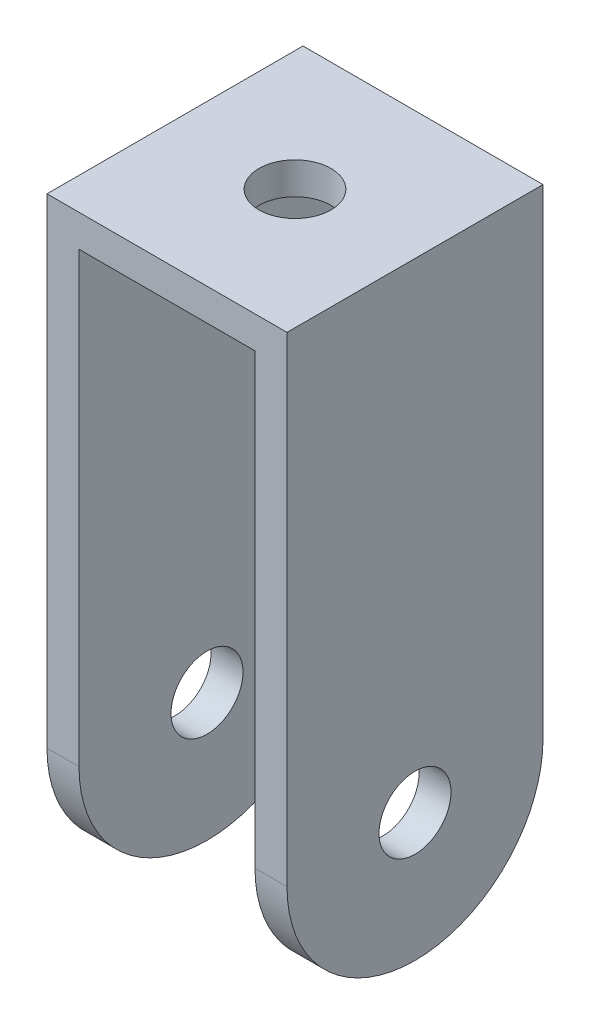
SolidWorks part; units mm, degrees
ref_plane "Front Plane" through (0, 0, 0) normal (0, 0, 1) x (1, 0, 0)
ref_plane "Top Plane" through (0, 0, 0) normal (0, 1, 0) x (1, 0, 0)
ref_plane "Right Plane" through (0, 0, 0) normal (1, 0, 0) x (0, 0, -1)
sketch "Sketch1" plane through (0, 0, 0) normal (0, 0, 1) x (1, 0, 0)
  line L0 (0, 0) -> (0, 45.2301)
  line L1 (0, 45.2301) -> (15, 45.2301)
  line L2 (15, 45.2301) -> (15, 0)
  line L3 (15, 0) -> (13, 0)
  line L4 (13, 0) -> (13, 43.2301)
  line L5 (13, 43.2301) -> (2, 43.2301)
  line L6 (2, 43.2301) -> (2, 0)
  line L7 (2, 0) -> (0, 0)
  dimension "D1" = 15
  dimension "D2" = 2
  dimension "D3" = 2
  dimension "D4" = 2
extrude "Extrude1" add sketch "Sketch1" along normal blind 16
sketch "Sketch2" plane through (0, 45.2301, 0) normal (0, 1, 0) x (1, 0, 0)
  line L0 (0, 0) -> (15, -16) construction
  circle A0 centre (7.5, -8) radius 2.25
  dimension "D1" = 4.5
extrude "Extrude2" cut sketch "Sketch2" against normal through all
sketch "Sketch3" plane through (15, 0, 0) normal (1, 0, 0) x (0, 0, -1)
  line L0 (-8, 45.2301) -> (-8, 15.2301) construction
  line L1 (-16, 45.2301) -> (0, 45.2301) construction
  line L2 (0, 15.2301) -> (0, 0)
  line L3 (0, 0) -> (-16, 0)
  line L4 (-16, 0) -> (-16, 15.2301)
  circle A0 centre (-8, 15.2301) radius 2.25
  arc A1 (-16, 15.2301) -> (0, 15.2301) centre (-8, 15.2301) ccw
  dimension "D1" = 4.5
  dimension "D2" = 30
  dimension "D3" = 16
extrude "Extrude3" cut sketch "Sketch3" against normal blind 16
